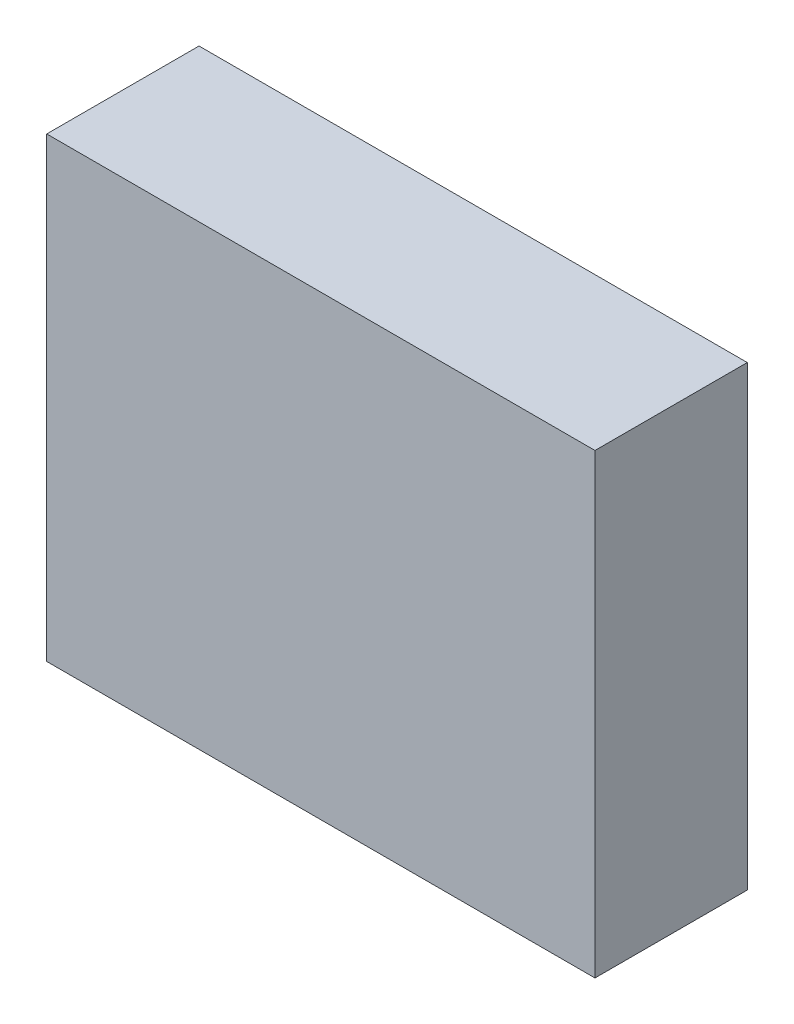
SolidWorks part; units mm, degrees
ref_plane "Front Plane" through (0, 0, 0) normal (0, 0, 1) x (1, 0, 0)
ref_plane "Top Plane" through (0, 0, 0) normal (0, 1, 0) x (1, 0, 0)
ref_plane "Right Plane" through (0, 0, 0) normal (1, 0, 0) x (0, 0, -1)
sketch "GENERAL" plane through (0, 0, 0) normal (0, 0, 1) x (1, 0, 0)
  line L8 (-1.8, -1.5) -> (1.8, -1.5)
  line L9 (1.8, -1.5) -> (1.8, 1.5)
  line L10 (1.8, 1.5) -> (-1.8, 1.5)
  line L11 (-1.8, 1.5) -> (-1.8, -1.5)
extrude "Boss-Extrude1" add sketch "GENERAL" along normal blind 1
